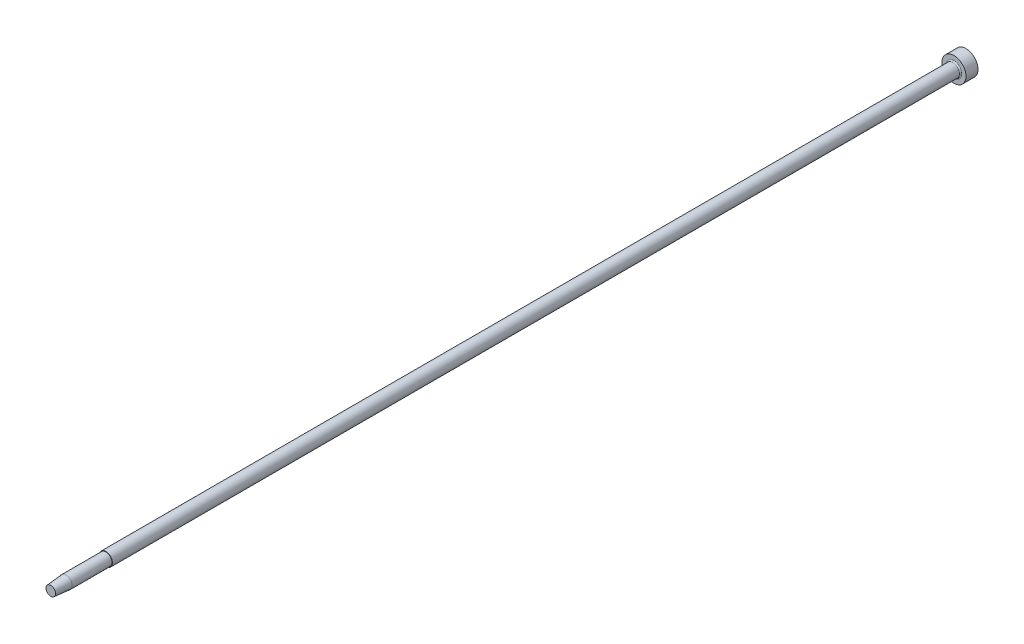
SolidWorks part; units mm, degrees
ref_plane "Face" through (0, 0, 0) normal (0, 0, 1) x (1, 0, 0)
ref_plane "Dessus" through (0, 0, 0) normal (0, 1, 0) x (1, 0, 0)
ref_plane "Droite" through (0, 0, 0) normal (1, 0, 0) x (0, 0, -1)
sketch "Esquisse1" plane through (0, 0, 0) normal (0, 0, 1) x (1, 0, 0)
  circle A0 centre (0, 0) radius 2
  dimension "D1" = 4
extrude "Tête" add sketch "Esquisse1" along normal blind 2
sketch "Esquisse2" plane through (0, 0, 2) normal (0, 0, 1) x (1, 0, 0)
  circle A0 centre (0, 0) radius 1.1
  dimension "D1" = 2.2
extrude "Partie active" add sketch "Esquisse2" along normal offset from surface (158 mm away) 160
fillet "Congé1" radius 0.2
sketch "Esquisse3" plane through (0, 0, 160) normal (0, 0, 1) x (1, 0, 0)
  circle A1 centre (0, 0) radius 1.1
  circle A2 centre (0, 0) radius 1.1
  dimension "D1" = 0
extrude "Mise à longueur" cut sketch "Esquisse3" against normal up to surface (7.7092 mm away)
other "Empreinte1"
other "Carter<1>@jeu blocs empreintes droit_Etudiant_Corrigé"
